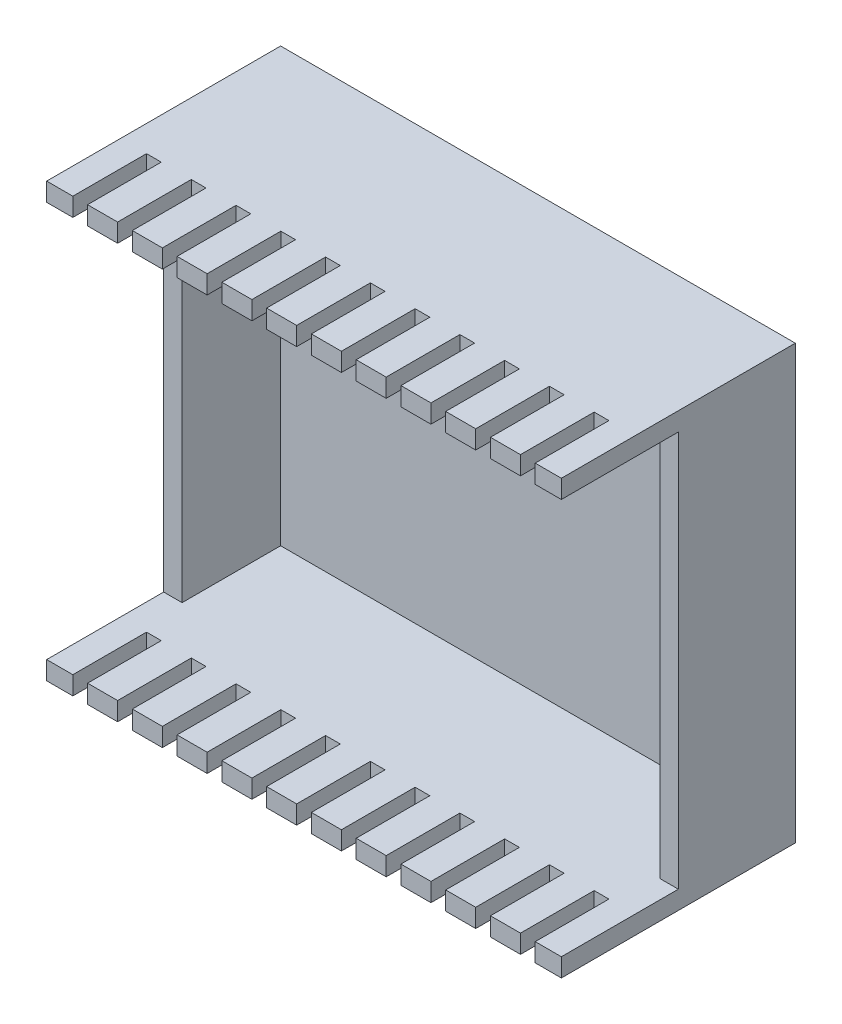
SolidWorks part; units mm, degrees
ref_plane "Front Plane" through (0, 0, 0) normal (0, 0, 1) x (1, 0, 0)
ref_plane "Top Plane" through (0, 0, 0) normal (0, 1, 0) x (1, 0, 0)
ref_plane "Right Plane" through (0, 0, 0) normal (1, 0, 0) x (0, 0, -1)
sketch "Sketch1" plane through (0, 0, 0) normal (0, 0, 1) x (1, 0, 0)
  line L1 (-13.97, 11.7475) -> (13.97, 11.7475)
  line L2 (-13.97, 11.7475) -> (-13.97, -11.7475)
  line L3 (-13.97, -11.7475) -> (13.97, -11.7475)
  line L4 (13.97, 11.7475) -> (13.97, -11.7475)
  line L5 (-13.97, 11.7475) -> (13.97, -11.7475) construction
  line L6 (-13.97, -11.7475) -> (13.97, 11.7475) construction
  point P0 (0, 0)
  dimension "D1" = 23.495
  dimension "D2" = 27.94
extrude "Boss-Extrude1" add sketch "Sketch1" along normal blind 12.7
sketch "Sketch2" plane through (0, 0, 12.7) normal (0, 0, 1) x (1, 0, 0)
  line L0 (13.97, -11.7475) -> (13.97, 11.7475) construction
  line L1 (-12.97, 10.7475) -> (12.97, 10.7475)
  line L2 (-12.97, 10.7475) -> (-12.97, -10.7475)
  line L3 (-12.97, -10.7475) -> (12.97, -10.7475)
  line L4 (12.97, 10.7475) -> (12.97, -10.7475)
  line L5 (-12.97, 10.7475) -> (12.97, -10.7475) construction
  line L6 (-12.97, -10.7475) -> (12.97, 10.7475) construction
  line L7 (13.97, 11.7475) -> (-13.97, 11.7475) construction
  point P0 (0, 0)
  dimension "D1" = 1
  dimension "D2" = 1
extrude "Cut-Extrude1" cut sketch "Sketch2" against normal offset from surface (11.7 mm away) 1
sketch "Sketch3" plane through (0, -11.7475, 0) normal (0, -1, 0) x (1, 0, 0)
  line L0 (0, 0) -> (0, 12.7) construction
  line L1 (-13.97, 12.7) -> (13.97, 12.7) construction
  line L2 (2.03, 16.7) -> (2.83, 16.7)
  line L3 (-0.4, 16.7) -> (0.4, 16.7)
  line L4 (-0.4, 16.7) -> (-0.4, 8.7)
  line L5 (-0.4, 8.7) -> (0.4, 8.7)
  line L6 (0.4, 16.7) -> (0.4, 8.7)
  line L7 (-0.4, 16.7) -> (0.4, 8.7) construction
  line L8 (-0.4, 8.7) -> (0.4, 16.7) construction
  line L9 (2.03, 16.7) -> (2.03, 8.7)
  line L10 (2.03, 8.7) -> (2.83, 8.7)
  line L11 (2.83, 16.7) -> (2.83, 8.7)
  line L12 (2.03, 16.7) -> (2.83, 8.7) construction
  line L13 (2.03, 8.7) -> (2.83, 16.7) construction
  line L14 (4.46, 16.7) -> (5.26, 16.7)
  line L15 (4.46, 16.7) -> (4.46, 8.7)
  line L16 (4.46, 8.7) -> (5.26, 8.7)
  line L17 (5.26, 16.7) -> (5.26, 8.7)
  line L18 (4.46, 16.7) -> (5.26, 8.7) construction
  line L19 (4.46, 8.7) -> (5.26, 16.7) construction
  line L20 (6.89, 16.7) -> (7.69, 16.7)
  line L21 (6.89, 16.7) -> (6.89, 8.7)
  line L22 (6.89, 8.7) -> (7.69, 8.7)
  line L23 (7.69, 16.7) -> (7.69, 8.7)
  line L24 (6.89, 16.7) -> (7.69, 8.7) construction
  line L25 (6.89, 8.7) -> (7.69, 16.7) construction
  line L26 (9.32, 16.7) -> (10.12, 16.7)
  line L27 (9.32, 16.7) -> (9.32, 8.7)
  line L28 (9.32, 8.7) -> (10.12, 8.7)
  line L29 (10.12, 16.7) -> (10.12, 8.7)
  line L30 (9.32, 16.7) -> (10.12, 8.7) construction
  line L31 (9.32, 8.7) -> (10.12, 16.7) construction
  line L32 (11.75, 16.7) -> (12.55, 16.7)
  line L33 (11.75, 16.7) -> (11.75, 8.7)
  line L34 (11.75, 8.7) -> (12.55, 8.7)
  line L35 (12.55, 16.7) -> (12.55, 8.7)
  line L36 (11.75, 16.7) -> (12.55, 8.7) construction
  line L37 (11.75, 8.7) -> (12.55, 16.7) construction
  line L38 (-11.75, 8.7) -> (-12.55, 16.7) construction
  line L39 (-11.75, 16.7) -> (-12.55, 8.7) construction
  line L40 (-9.32, 8.7) -> (-10.12, 16.7) construction
  line L41 (-9.32, 16.7) -> (-10.12, 8.7) construction
  line L42 (-6.89, 8.7) -> (-7.69, 16.7) construction
  line L43 (-6.89, 16.7) -> (-7.69, 8.7) construction
  line L44 (-4.46, 8.7) -> (-5.26, 16.7) construction
  line L45 (-4.46, 16.7) -> (-5.26, 8.7) construction
  line L46 (-2.03, 8.7) -> (-2.83, 16.7) construction
  line L47 (-2.03, 16.7) -> (-2.83, 8.7) construction
  line L48 (-12.55, 16.7) -> (-12.55, 8.7)
  line L49 (-11.75, 8.7) -> (-12.55, 8.7)
  line L50 (-11.75, 16.7) -> (-11.75, 8.7)
  line L51 (-11.75, 16.7) -> (-12.55, 16.7)
  line L52 (-10.12, 16.7) -> (-10.12, 8.7)
  line L53 (-9.32, 8.7) -> (-10.12, 8.7)
  line L54 (-9.32, 16.7) -> (-9.32, 8.7)
  line L55 (-9.32, 16.7) -> (-10.12, 16.7)
  line L56 (-7.69, 16.7) -> (-7.69, 8.7)
  line L57 (-6.89, 8.7) -> (-7.69, 8.7)
  line L58 (-6.89, 16.7) -> (-6.89, 8.7)
  line L59 (-6.89, 16.7) -> (-7.69, 16.7)
  line L60 (-5.26, 16.7) -> (-5.26, 8.7)
  line L61 (-4.46, 8.7) -> (-5.26, 8.7)
  line L62 (-4.46, 16.7) -> (-4.46, 8.7)
  line L63 (-4.46, 16.7) -> (-5.26, 16.7)
  line L64 (-2.83, 16.7) -> (-2.83, 8.7)
  line L65 (-2.03, 8.7) -> (-2.83, 8.7)
  line L66 (-2.03, 16.7) -> (-2.03, 8.7)
  line L67 (-2.03, 16.7) -> (-2.83, 16.7)
  dimension "D1" = 8
  dimension "D2" = 0.8
  dimension "D3" = 6
extrude "Cut-Extrude2" cut sketch "Sketch3" against normal through all
sketch "Sketch4" plane through (0, 0, 12.7) normal (0, 0, 1) x (1, 0, 0)
  line L0 (-13.97, 0) -> (13.97, 0) construction
  line L1 (-13.97, 11.7475) -> (-13.97, -11.7475) construction
  line L2 (13.97, -11.7475) -> (13.97, 11.7475) construction
  line L3 (-2.03, -10.7475) -> (-0.4, -10.7475) construction
  line L4 (-18.3241, 10.7475) -> (18.3241, 10.7475)
  line L5 (-18.3241, 10.7475) -> (-18.3241, -10.7475)
  line L6 (-18.3241, -10.7475) -> (18.3241, -10.7475)
  line L7 (18.3241, 10.7475) -> (18.3241, -10.7475)
  line L8 (-18.3241, 10.7475) -> (18.3241, -10.7475) construction
  line L9 (-18.3241, -10.7475) -> (18.3241, 10.7475) construction
  point P6 (0, 0)
extrude "Cut-Extrude3" cut sketch "Sketch4" against normal blind 6.35
